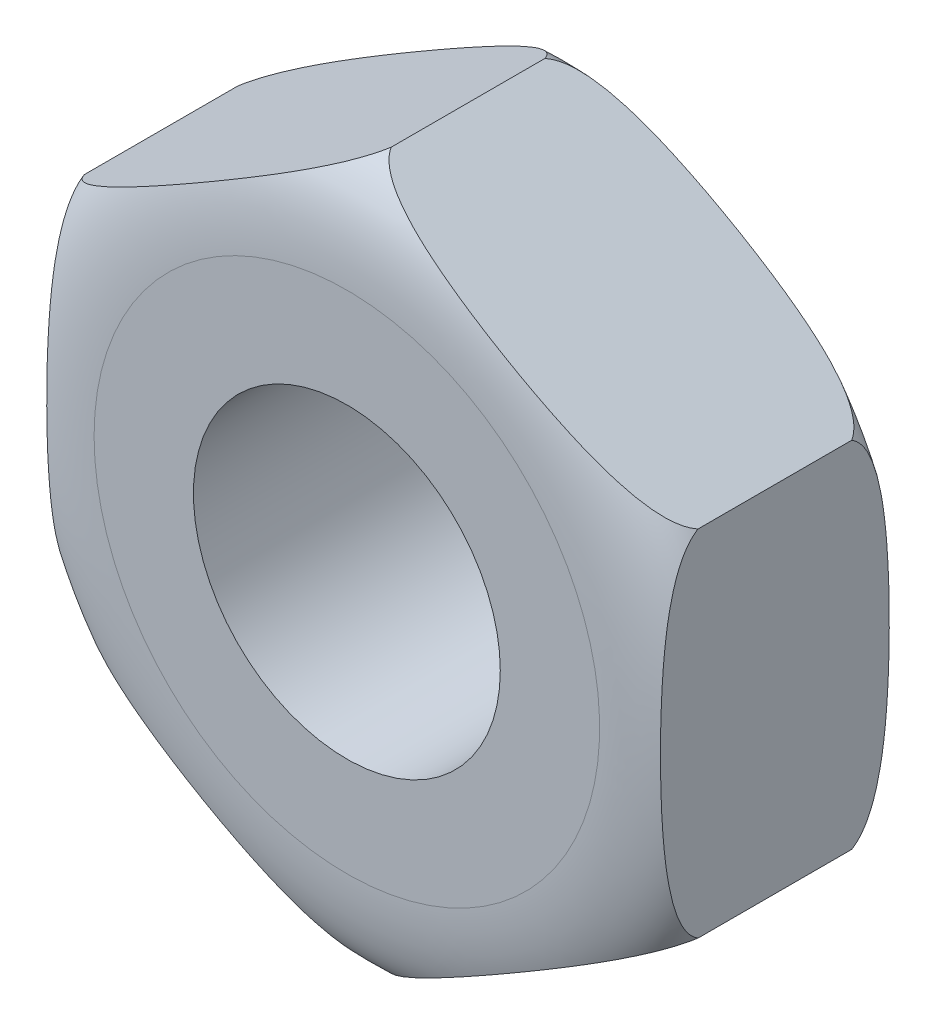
SolidWorks part; units mm, degrees
ref_plane "Plan de face" through (0, 0, 0) normal (0, 0, 1) x (1, 0, 0)
ref_plane "Plan de dessus" through (0, 0, 0) normal (0, 1, 0) x (1, 0, 0)
ref_plane "Plan de droite" through (0, 0, 0) normal (1, 0, 0) x (0, 0, -1)
sketch "Esquisse1" plane through (0, 0, 0) normal (0, 0, 1) x (1, 0, 0)
  line L1 (0, 2.1939) -> (-1.9, 1.097)
  line L2 (-1.9, 1.097) -> (-1.9, -1.097)
  line L3 (-1.9, -1.097) -> (0, -2.1939)
  line L4 (0, -2.1939) -> (1.9, -1.097)
  line L5 (1.9, -1.097) -> (1.9, 1.097)
  line L6 (1.9, 1.097) -> (0, 2.1939)
  circle A0 centre (0, 0) radius 1.9 construction
  circle A1 centre (0, 0) radius 0.95
extrude "Extrusion1" add sketch "Esquisse1" along normal blind 1.5
ref_plane "Plan1" through (0, 0, 0) normal (-0.5, -0.866, 0) x (-0.866, 0.5, 0)
sketch "Esquisse3" plane through (0, 0, 0) normal (-0.5, -0.866, 0) x (-0.866, 0.5, 0)
  line L0 (0, 0) -> (0, -1.5) construction
  line L1 (-1.097, -1.5) -> (1.097, -1.5) construction
  line L2 (0, -1.5) -> (0, -0.75) construction
  line L3 (0, -0.75) -> (-2.8037, -0.75) construction
  line L4 (-2.1939, 0) -> (-1.097, 0) construction
  line L5 (-2.1939, -1.5) -> (-2.1939, 0) construction
  line L6 (-2.1939, -0.2745) -> (-2.1939, -1.2255)
  line L7 (-1.5197, 0) -> (-1.5197, 0.3846)
  line L8 (-1.5197, 0.3846) -> (-2.5205, 0.3846)
  line L9 (-2.5205, 0.3846) -> (-2.5205, -1.8846)
  line L10 (-1.5197, -1.5) -> (-1.5197, -1.8846)
  line L11 (-1.5197, -1.8846) -> (-2.5205, -1.8846)
  spline S0 degree 3 poles (-1.5197, 0) (-1.7882, 0.0032) (-2.1262, -0.0487) (-2.1939, -0.2745) knots 0 0 0 0 1 1 1 1
  spline S1 degree 3 poles (-1.5197, -1.5) (-1.7882, -1.5032) (-2.1262, -1.4513) (-2.1939, -1.2255) knots 0 0 0 0 1 1 1 1
  point P20 (-2.5205, -0.75)
revolve "Enlèvement de matière-Révolution2" cut sketch "Esquisse3" angle 360 about L0
